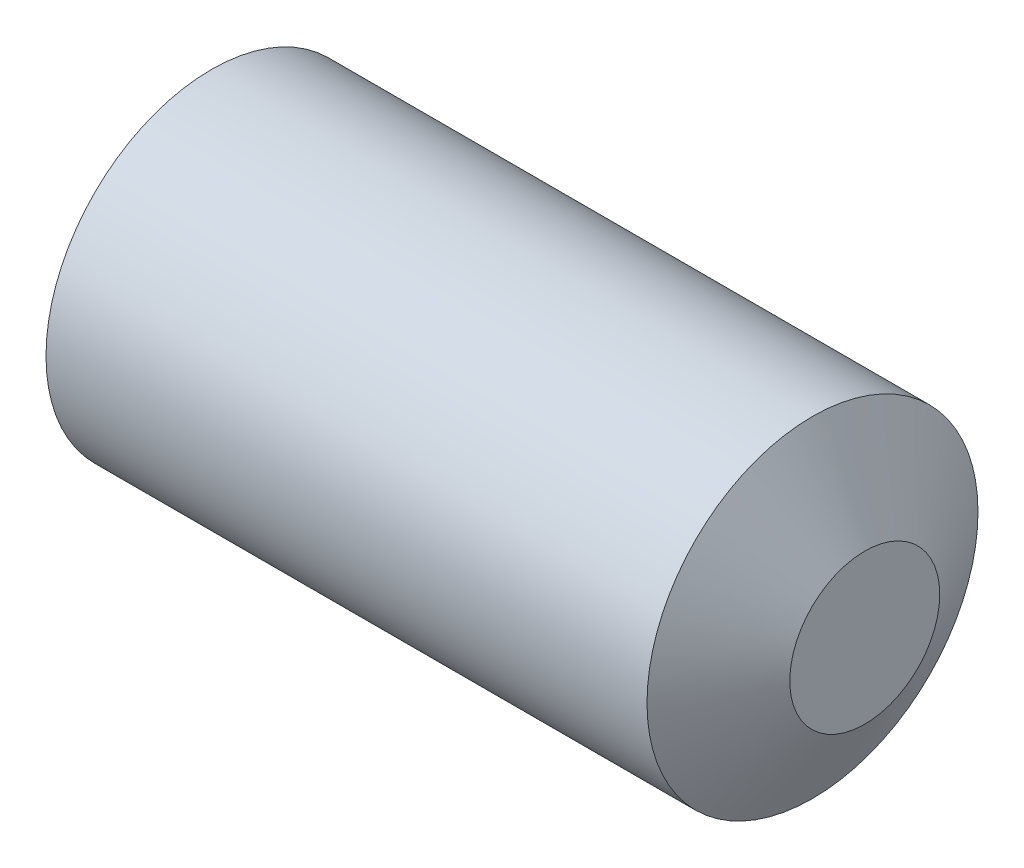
SolidWorks part; units mm, degrees
ref_plane "Front Plane" through (0, 0, 0) normal (0, 0, 1) x (1, 0, 0)
ref_plane "Top Plane" through (0, 0, 0) normal (0, 1, 0) x (1, 0, 0)
ref_plane "Right Plane" through (0, 0, 0) normal (1, 0, 0) x (0, 0, -1)
sketch "Sketch1" plane through (0, 0, 0) normal (0, 1, 0) x (1, 0, 0)
  line L0 (0, 0) -> (0, 1.0932)
  line L1 (0, 1.0932) -> (-0.762, 2.413)
  line L2 (-0.762, 2.413) -> (-9.525, 2.413)
  line L3 (-9.525, 2.413) -> (-9.525, 0)
  line L4 (-9.525, 0) -> (0, 0)
  line L5 (0, 0) -> (-114.6181, 0) construction
  dimension "D1" = 9.525
  dimension "D2" = 4.826
  dimension "D3" = 120
  dimension "D4" = 0.762
revolve "Revolve1" add sketch "Sketch1" angle 360 about L5
sketch "Sketch2" plane through (-9.525, 0, 0) normal (-1, 0, 0) x (0, 0, 1)
  line L0 (0, 1.3748) -> (1.1906, 0.6874)
  line L1 (1.1906, 0.6874) -> (1.1906, -0.6874)
  line L2 (1.1906, -0.6874) -> (0, -1.3748)
  line L3 (0, -1.3748) -> (-1.1906, -0.6874)
  line L4 (-1.1906, -0.6874) -> (-1.1906, 0.6874)
  line L5 (-1.1906, 0.6874) -> (0, 1.3748)
  circle A0 centre (0, 0) radius 1.3748 construction
  dimension "D1" = 2.3813
extrude "Cut-Extrude1" cut sketch "Sketch2" against normal blind 3.81
